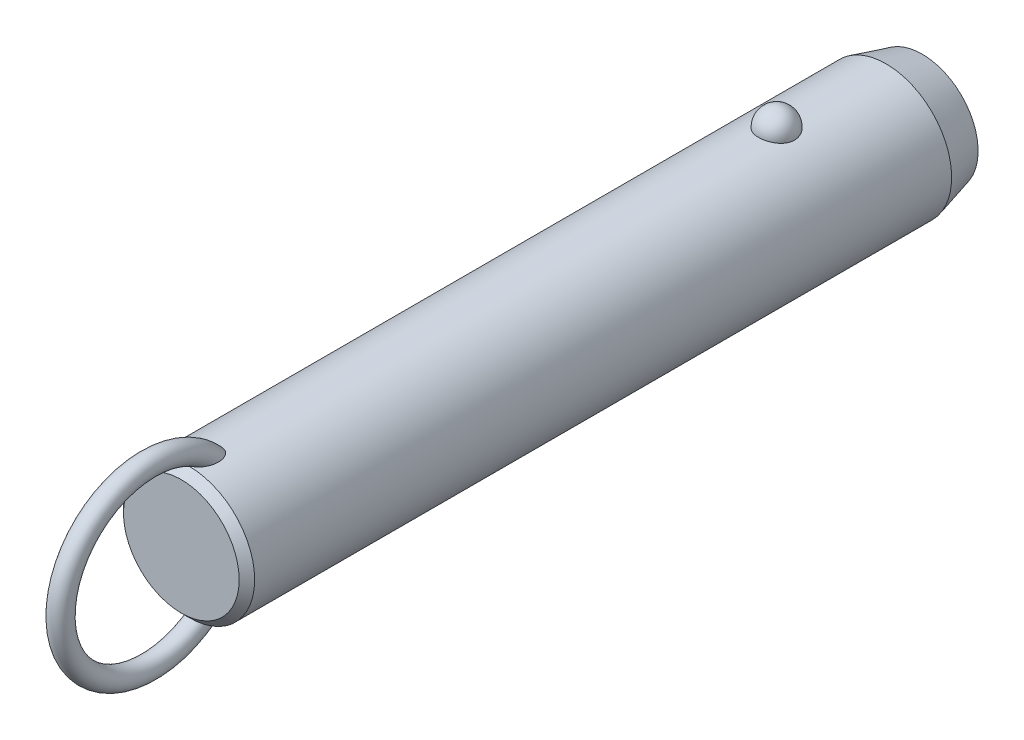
SolidWorks part; units mm, degrees
ref_plane "Front Plane" through (0, 0, 0) normal (0, 0, 1) x (1, 0, 0)
ref_plane "Top Plane" through (0, 0, 0) normal (0, 1, 0) x (1, 0, 0)
ref_plane "Right Plane" through (0, 0, 0) normal (1, 0, 0) x (0, 0, -1)
sketch "Sketch2" plane through (0, 0, 0) normal (0, 0, 1) x (1, 0, 0)
  circle A0 centre (0, 0) radius 12.7
  point P3 (0, 12.7)
  dimension "D1" = 25.4
extrude "Boss-Extrude1" add sketch "Sketch2" along normal blind 99.1
sketch "Sketch3" plane through (0, 0, 0) normal (0, 0, -1) x (-1, 0, 0)
  circle A0 centre (0, 0) radius 12.7
  dimension "D1" = 25.4
extrude "Boss-Extrude2" add sketch "Sketch3" along normal blind 31.7
chamfer "Chamfer1" distance 7 angle 15 1 edges at (-12.7, 0, -31.7)
sketch "Sketch12" plane through (0, 0, 0) normal (1, 0, 0) x (0, 0, -1)
  line L0 (-99.1, 12.7) -> (-99.1, -12.7) construction
  point P0 (-99.1, 0)
sketch "Sketch13" plane through (0, 0, 0) normal (1, 0, 0) x (0, 0, -1)
  circle A0 centre (-118.15, 0) radius 19.05
  point P2 (-99.1, 0)
  dimension "D1" = 38.1
sketch "Sketch14" plane through (0, 0, 0) normal (0, 1, 0) x (1, 0, 0)
  circle A0 centre (0, -101.1) radius 2
  point P2 (0, -99.1)
  dimension "D1" = 4
sweep "Sweep1" add profiles "Sketch14" path "Sketch13"
sketch "Sketch15" plane through (0, 0, 99.1) normal (0, 0, 1) x (1, 0, 0)
  circle A0 centre (0, 0) radius 12.7
  dimension "D1" = 25.4
extrude "Boss-Extrude3" add sketch "Sketch15" along normal blind 12.7
chamfer "Chamfer2" distance 1.5 angle 45 1 edges at (12.7, 0, 111.8)
sketch "Sketch18" plane through (0, 0, 0) normal (1, 0, 0) x (0, 0, -1)
  line L0 (24.7, 12.7) -> (-103.951, 12.7) construction
  line L1 (3.5, 16.2) -> (3.5, 9.2)
  line L2 (-103.951, -12.7) -> (24.7, -12.7) construction
  arc A0 (3.5, 16.2) -> (3.5, 9.2) centre (3.5, 12.7) ccw
  point P4 (0, 12.7)
  dimension "D1" = 28.9
revolve "Revolve1" add sketch "Sketch18" angle 360 about L1
